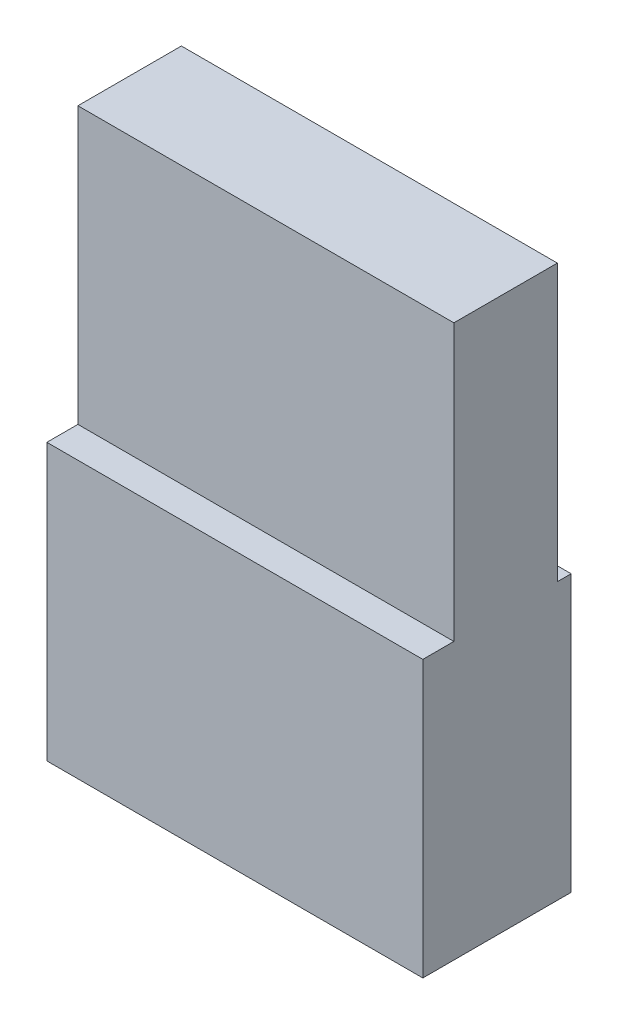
SolidWorks part; units mm, degrees
ref_plane "Front Plane" through (0, 0, 0) normal (0, 0, 1) x (1, 0, 0)
ref_plane "Top Plane" through (0, 0, 0) normal (0, 1, 0) x (1, 0, 0)
ref_plane "Right Plane" through (0, 0, 0) normal (1, 0, 0) x (0, 0, -1)
sketch "Sketch1" plane through (0, 0, 0) normal (0, 1, 0) x (1, 0, 0)
  line L1 (-2.725, 1.075) -> (2.725, 1.075)
  line L2 (-2.725, 1.075) -> (-2.725, -1.075)
  line L3 (-2.725, -1.075) -> (2.725, -1.075)
  line L4 (2.725, 1.075) -> (2.725, -1.075)
  line L5 (-2.725, 1.075) -> (2.725, -1.075) construction
  line L6 (-2.725, -1.075) -> (2.725, 1.075) construction
  point P0 (0, 0)
  dimension "D1" = 5.45
  dimension "D2" = 2.15
extrude "Boss-Extrude1" add sketch "Sketch1" along normal blind 4
sketch "Sketch2" plane through (0, 4, 0) normal (0, 1, 0) x (1, 0, 0)
  line L0 (-2.725, 1.075) -> (-2.725, -1.075) construction
  line L1 (2.725, 0.875) -> (-2.725, 0.875)
  line L2 (2.725, 0.875) -> (2.725, -0.625)
  line L3 (2.725, -0.625) -> (-2.725, -0.625)
  line L4 (-2.725, 0.875) -> (-2.725, -0.625)
  line L5 (2.725, 0.875) -> (-2.725, -0.625) construction
  line L6 (2.725, -0.625) -> (-2.725, 0.875) construction
  line L7 (2.725, 1.075) -> (-2.725, 1.075) construction
  point P0 (0, 0.125)
  dimension "D1" = 1.5
  dimension "D2" = 0.2
extrude "Boss-Extrude2" add sketch "Sketch2" along normal blind 4
